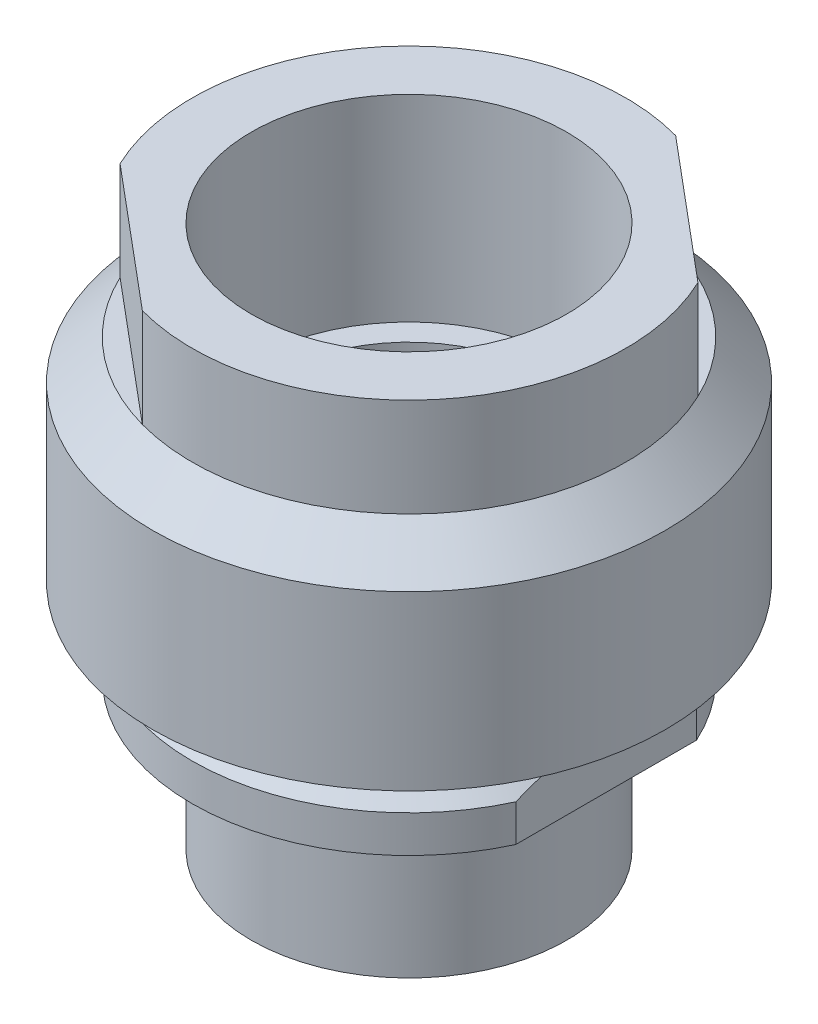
SolidWorks part; units mm, degrees
ref_plane "Front" through (0, 0, 0) normal (0, 0, 1) x (1, 0, 0)
ref_plane "Top" through (0, 0, 0) normal (0, 1, 0) x (1, 0, 0)
ref_plane "Right" through (0, 0, 0) normal (1, 0, 0) x (0, 0, -1)
sketch "Schizzo1" plane through (0, 0, 0) normal (0, 0, 1) x (1, 0, 0)
  line L0 (0, 0) -> (0, 71.1791) construction
  line L1 (16, 0) -> (22, 0)
  line L2 (22, 0) -> (22, 3.75)
  line L3 (13.5, 20) -> (16, 20)
  line L4 (16, 20) -> (16, 40)
  line L6 (13.5, 20) -> (13.5, -15)
  line L7 (13.5, -15) -> (16, -15)
  line L8 (16, -15) -> (16, 0)
  line L10 (18.75, 10.5) -> (18.75, 7)
  line L11 (18.75, 7) -> (22, 3.75)
  line L17 (23.5, 8.5) -> (26, 8.5)
  line L18 (23.5, 10.5) -> (23.5, 8.5)
  line L19 (26, 8.5) -> (26, 26)
  line L20 (22, 30) -> (26, 26)
  line L21 (22, 40) -> (22, 30)
  line L22 (22, 40) -> (16, 40)
  line L23 (23.5, 10.5) -> (18.75, 10.5)
  dimension "D2" = 27
  dimension "D3" = 15
  dimension "D4" = 44
  dimension "D5" = 3.75
  dimension "D6" = 37.5
  dimension "D7" = 52
  dimension "D8" = 44
  dimension "D9" = 40
  dimension "D10" = 8.5
  dimension "D11" = 32
  dimension "D12" = 47
  dimension "D13" = 45
  dimension "D14" = 10.5
  dimension "D15" = 26
  dimension "D16" = 45
  dimension "D17" = 20
revolve "Rivoluzione1" add sketch "Schizzo1" angle 360 about L0
sketch "Schizzo5" plane through (0, 0, 0) normal (0, -1, 0) x (1, 0, 0)
  line L0 (-20, 9.1652) -> (-20, -9.1652)
  line L1 (20, 9.1652) -> (20, -9.1652)
  arc A0 (-20, 9.1652) -> (-20, -9.1652) centre (0, 0) ccw
  circle A1 centre (0, 0) radius 22
  arc A2 (20, -9.1652) -> (20, 9.1652) centre (0, 0) ccw
  dimension "D2" = 40
  dimension "D1" = 0
extrude "Taglio-Estrusione1" cut sketch "Schizzo5" against normal blind 20
sketch "Schizzo6" plane through (0, 40, 0) normal (0, 1, 0) x (1, 0, 0)
  line L0 (5.8348, 21.2121) -> (19.8767, 9.4296)
  line L1 (-19.8767, -9.4296) -> (-5.8348, -21.2121)
  line L2 (0, -50) -> (0, 50) construction
  arc A0 (19.8767, 9.4296) -> (5.8348, 21.2121) centre (0, 0) ccw
  circle A1 centre (0, 0) radius 22
  arc A2 (-19.8767, -9.4296) -> (-5.8348, -21.2121) centre (0, 0) ccw
  dimension "D2" = 20
  dimension "D3" = 40
  dimension "D4" = 50
  dimension "D1" = 0
extrude "Taglio-Estrusione2" cut sketch "Schizzo6" against normal blind 10
